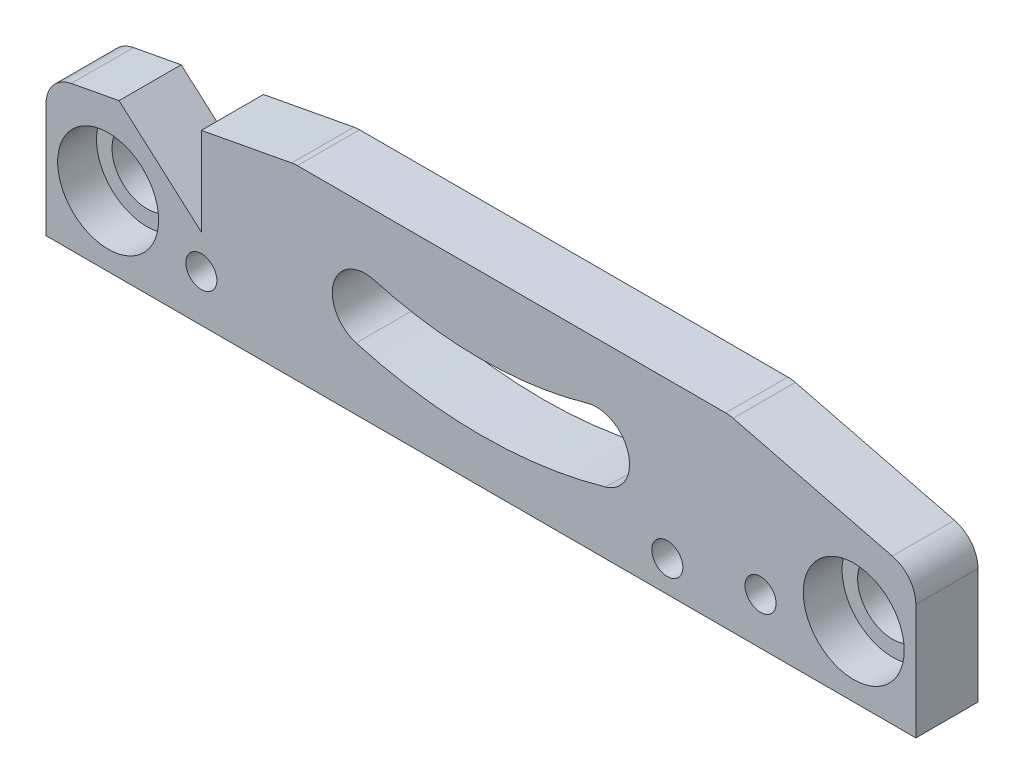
SolidWorks part; units mm, degrees
ref_plane "Front" through (0, 0, 0) normal (0, 0, 1) x (1, 0, 0)
ref_plane "Top" through (0, 0, 0) normal (0, 1, 0) x (1, 0, 0)
ref_plane "Right" through (0, 0, 0) normal (1, 0, 0) x (0, 0, -1)
sketch "Sketch1" plane through (0, 0, 0) normal (0, 0, 1) x (1, 0, 0)
  line L0 (0, 67.1585) -> (0, -46.3958) construction
  line L1 (44.45, 0) -> (-44.45, 0)
  line L2 (-44.45, 0) -> (-44.45, 19.05)
  line L3 (44.45, 0) -> (44.45, 19.05)
  line L4 (-44.45, 19.05) -> (44.45, 19.05)
  point P6 (0, 0)
  point P9 (0, 19.05)
  dimension "D1" = 88.9
  dimension "D2" = 19.05
extrude "Base-Extrude" add sketch "Sketch1" along normal blind 6.35
sketch "Sketch2" plane through (0, 0, 6.35) normal (0, 0, 1) x (1, 0, 0)
  line L0 (44.45, 14.2875) -> (25.4, 19.05)
  line L1 (44.45, 0) -> (44.45, 19.05) construction
  line L2 (-44.45, 19.05) -> (44.45, 19.05) construction
  line L3 (44.45, 0) -> (-44.45, 0) construction
  line L4 (25.4, 19.05) -> (44.45, 19.05)
  line L5 (44.45, 14.2875) -> (44.45, 19.05)
  dimension "D1" = 14.2875
  dimension "D2" = 19.05
extrude "Cut-Extrude1" cut sketch "Sketch2" against normal through all
sketch "Sketch4" plane through (0, 0, 6.35) normal (0, 0, 1) x (1, 0, 0)
  line L0 (-44.45, 14.2875) -> (-19.05, 19.05)
  line L1 (-44.45, 0) -> (-44.45, 19.05) construction
  line L2 (-44.45, 19.05) -> (25.4, 19.05) construction
  dimension "D1" = 25.4
extrude "Cut-Extrude3" cut sketch "Sketch4" against normal through all
sketch "Sketch5" plane through (0, 0, 6.35) normal (0, 0, 1) x (1, 0, 0)
  line L0 (-36.9844, 15.6873) -> (-28.575, 8.2623)
  line L1 (-44.45, 14.2875) -> (-19.05, 19.05) construction
  line L2 (-19.05, 19.05) -> (-30.473, 6.1126) construction
  line L3 (-28.575, 8.2623) -> (-28.575, 17.2641)
  line L4 (-36.9844, 15.6873) -> (-28.575, 17.2641)
  line L5 (0, 59.1462) -> (0, -3.4396) construction
  line L6 (0, -50) -> (0, 50) construction
  line L7 (44.45, 0) -> (-44.45, 0) construction
  point P6 (0, 50.8)
  dimension "D1" = 90
  dimension "D2" = 50.8
  dimension "D3" = 50.8
extrude "Cut-Extrude4" cut sketch "Sketch5" against normal through all
sketch "Sketch6" plane through (0, 0, 6.35) normal (0, 0, 1) x (1, 0, 0)
  line L0 (0, 50.8) -> (-14.5667, 0) construction
  line L1 (44.45, 0) -> (-44.45, 0) construction
  line L2 (0, 50.8) -> (14.5667, 0) construction
  line L3 (0, 65.7216) -> (0, 18.1985) construction
  line L4 (0, -50) -> (0, 50) construction
  arc A0 (-10.8847, 12.8407) -> (10.8847, 12.8407) centre (0, 50.8) ccw
  arc A2 (12.7444, 6.3552) -> (-12.7444, 6.3552) centre (0, 50.8) cw
  arc A3 (11.8145, 9.5979) -> (-11.8145, 9.5979) centre (0, 50.8) cw construction
  arc A4 (-12.7444, 6.3552) -> (-10.8847, 12.8407) centre (-11.8145, 9.5979) cw
  arc A5 (10.8847, 12.8407) -> (12.7444, 6.3552) centre (11.8145, 9.5979) cw
  point P16 (0, 11.3109)
  point P17 (0, 7.9375)
  point P18 (0, 4.5641)
  dimension "D2" = 42.8625
  dimension "D3" = 6.7469
  dimension "D1" = 32
  dimension "D4" = 3.3734
  dimension "D5" = 50.8
extrude "Cut-Extrude5" cut sketch "Sketch6" against normal through all
fillet "Fillet1" radius 3.175 4 edges at (44.45, 14.2875, 3.175) (25.4, 19.05, 3.175) (-19.05, 19.05, 3.175) (-44.45, 14.2875, 3.175)
hole_wizard "Hole1" positions "Sketch8" profile "Sketch9" legacy
sketch "Sketch8" plane through (0, 0, 6.35) normal (0, 0, 1) x (1, 0, 0)
  line L0 (0, -50) -> (0, 50) construction
  line L1 (44.45, 0) -> (-44.45, 0) construction
  point P0 (38.1, 7.1438)
  dimension "D1" = 38.1
  dimension "D2" = 7.1437
sketch "Sketch9" plane through (38.1, 7.1438, 6.35) normal (1, 0, 0) x (0, -1, 0)
  line L0 (0, 0) -> (0, 6.35)
  line L1 (0, 6.35) -> (3.5719, 6.35)
  line L2 (3.5719, 6.35) -> (3.5719, 3.9688)
  line L3 (3.5719, 3.9688) -> (5.1594, 3.9688)
  line L4 (5.1594, 3.9688) -> (5.1594, 0)
  line L5 (5.1594, 0) -> (0, 0)
  line L6 (0, 110) -> (0, -10) construction
pattern_linear "LPattern1" count 2 spacing 76.2 along (-1, 0, 0) of "Hole1"
other "Hole2"
sketch "Sketch10" plane through (0, 0, 6.35) normal (0, 0, 1) x (1, 0, 0)
  line L0 (44.45, 0) -> (-44.45, 0) construction
  line L1 (0, -50) -> (0, 50) construction
  circle A0 centre (28.575, 4.7625) radius 1.5875
  dimension "D1" = 3.175
  dimension "D2" = 4.7625
  dimension "D3" = 28.575
sketch "Sketch11" plane through (-6.4225, 2.9366, 6.35) normal (0, 0, 1) x (1, 0, 0)
  line L0 (50.8725, -2.9366) -> (-38.0275, -2.9366) construction
  line L1 (6.4225, -52.9366) -> (6.4225, 47.0634) construction
  circle A0 centre (25.4725, 0.2384) radius 1.5875
  dimension "D1" = 3.175
  dimension "D2" = 3.175
  dimension "D3" = 19.05
other "Hole3"
pattern_linear "LPattern2" count 2 spacing 57.15 along (-1, 0, 0) of "Hole2"
